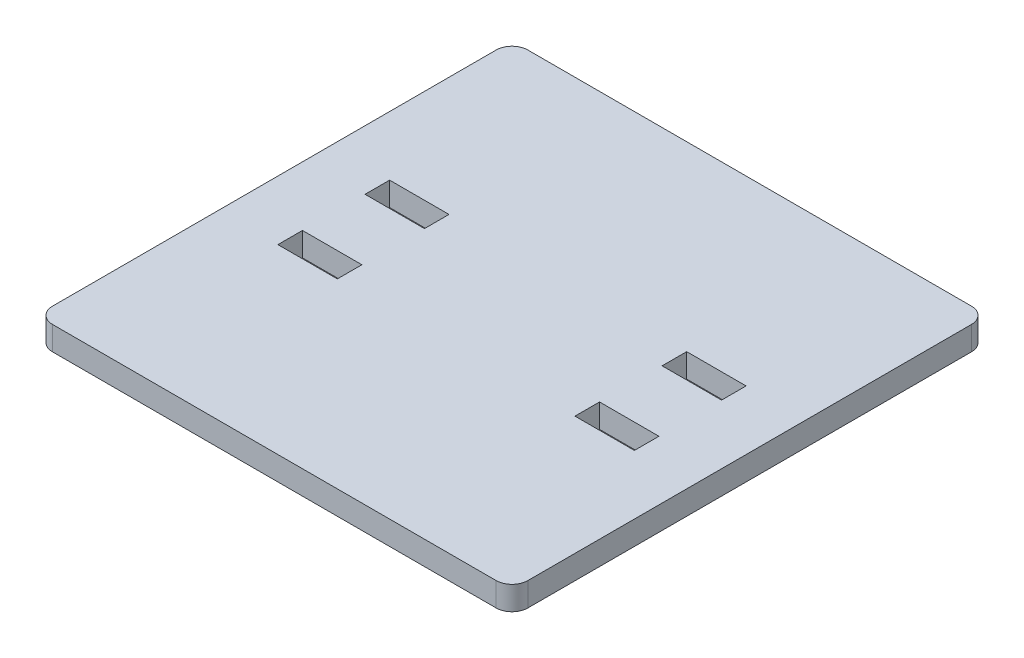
SolidWorks part; units mm, degrees
ref_plane "Front" through (0, 0, 0) normal (0, 0, 1) x (1, 0, 0)
ref_plane "Top" through (0, 0, 0) normal (0, 1, 0) x (1, 0, 0)
ref_plane "Right" through (0, 0, 0) normal (1, 0, 0) x (0, 0, -1)
sketch "Sketch1" plane through (0, 0, 0) normal (0, 1, 0) x (1, 0, 0)
  line L0 (-60, -60) -> (60, 60) construction
  line L1 (-60, -60) -> (60, -60)
  line L2 (-60, -60) -> (-60, 60)
  line L3 (-60, 60) -> (60, 60)
  line L4 (60, -60) -> (60, 60)
  line L5 (-60, 0) -> (60, 0) construction
  line L6 (0, 60) -> (0, -60) construction
  line L7 (60, -60) -> (-60, 60) construction
  dimension "D1" = 120
extrude "Boss-Extrude1" add sketch "Sketch1" along normal blind 6
fillet "Fillet1" radius 4 4 edges at (-60, 3, -60) (60, 3, -60) (60, 3, 60) (-60, 3, 60)
sketch "Sketch2" plane through (0, 6, 0) normal (0, 1, 0) x (1, 0, 0)
  line L0 (60, 0) -> (0, 0) construction
  line L2 (60, -56) -> (60, 56) construction
  line L3 (0, 0) -> (0, -60) construction
  line L4 (-56, -60) -> (56, -60) construction
  line B0 (-45, -14.1) -> (-30, -14.1)
  line B1 (-30, -14.1) -> (-30, -7.9)
  line B2 (-30, -7.9) -> (-45, -7.9)
  line B3 (-45, -7.9) -> (-45, -14.1)
  line B4 (-45, -11) -> (-30, -11) construction
  line B5 (-37.5, -7.9) -> (-37.5, -14.1) construction
  line B6 (30, -14.1) -> (45, -14.1)
  line B7 (45, -14.1) -> (45, -7.9)
  line B8 (45, -7.9) -> (30, -7.9)
  line B9 (30, -7.9) -> (30, -14.1)
  line B10 (30, -11) -> (45, -11) construction
  line B11 (37.5, -7.9) -> (37.5, -14.1) construction
  line B12 (-45, 7.9) -> (-30, 7.9)
  line B13 (-30, 7.9) -> (-30, 14.1)
  line B14 (-30, 14.1) -> (-45, 14.1)
  line B15 (-45, 14.1) -> (-45, 7.9)
  line B16 (-45, 11) -> (-30, 11) construction
  line B17 (-37.5, 14.1) -> (-37.5, 7.9) construction
  line B18 (30, 7.9) -> (45, 7.9)
  line B19 (45, 7.9) -> (45, 14.1)
  line B20 (45, 14.1) -> (30, 14.1)
  line B21 (30, 14.1) -> (30, 7.9)
  line B22 (30, 11) -> (45, 11) construction
  line B23 (37.5, 14.1) -> (37.5, 7.9) construction
  dimension "D1" = 75
  dimension "D2" = 49
sketch_block_instance "Block-laser-cut-slot-15x6-1"
sketch_block "Block-laser-cut-slot-15x6" parameters "D1"=15, "D2"=6.2
sketch_block_instance "Block-laser-cut-slot-15x6-2"
sketch_block_instance "Block-laser-cut-slot-15x6-3"
sketch_block_instance "Block-laser-cut-slot-15x6-4"
extrude "strut slots" cut sketch "Sketch2" against normal up to next
